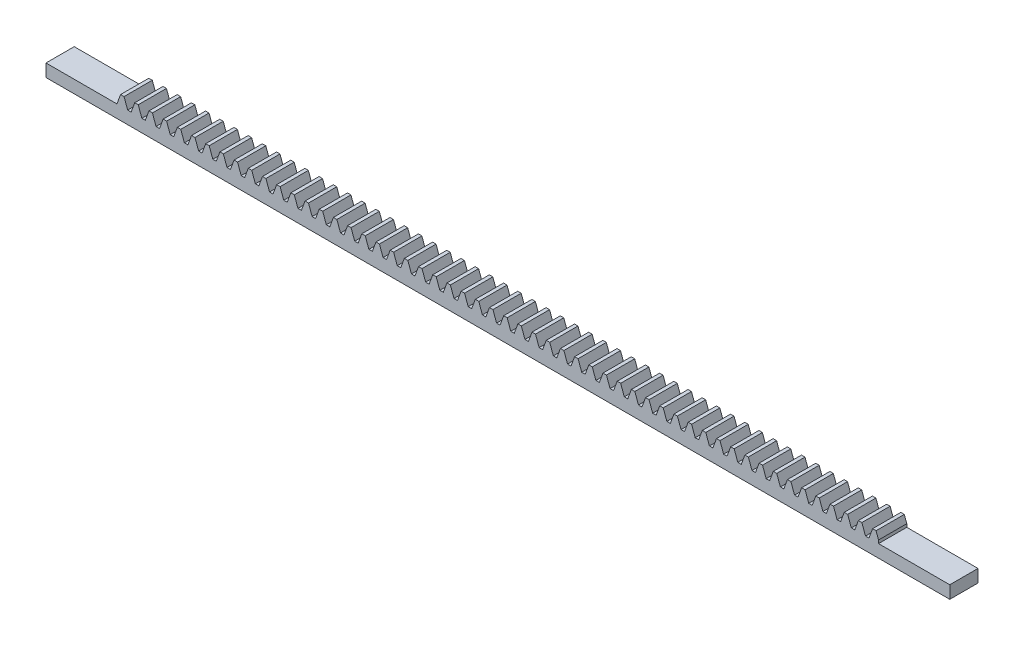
SolidWorks part; units mm, degrees
ref_plane "Plan de face" through (0, 0, 0) normal (0, 0, 1) x (1, 0, 0)
ref_plane "Plan de dessus" through (0, 0, 0) normal (0, 1, 0) x (1, 0, 0)
ref_plane "Plan de droite" through (0, 0, 0) normal (1, 0, 0) x (0, 0, -1)
sketch "Esquisse1" plane through (0, 0, 0) normal (0, 0, 1) x (1, 0, 0)
  line L1 (0, 0) -> (160, 0)
  line L2 (0, 0) -> (0, 4)
  line L3 (0, 4) -> (160, 4)
  line L4 (160, 0) -> (160, 4)
  dimension "D1" = 4
  dimension "D2" = 160
extrude "Boss.-Extru.1" add sketch "Esquisse1" along normal mid plane 5
sketch "Esquisse2" plane through (0, 0, 2.5) normal (0, 0, 1) x (1, 0, 0)
  line L0 (0.6406, 4) -> (0, 2.24)
  line L1 (0, 2.24) -> (-0.6154, 2.24)
  line L2 (-0.6154, 2.24) -> (-1.256, 4)
  line L3 (-1.256, 4) -> (0.6406, 4)
  line L4 (0, 11.789) -> (0, -2.5174) construction
  line L5 (2.512, 11.789) -> (2.512, -2.5174) construction
  line L6 (-0.8493, 7) -> (21.7954, 7) construction
  line L7 (0, 0) -> (160, 0) construction
  line L8 (160, 4) -> (0, 4) construction
  line L9 (0, 4) -> (0, 0) construction
  dimension "D1" = 2.512
  dimension "D2" = 70
  dimension "D3" = 70
  dimension "D4" = 1.256
  dimension "D5" = 7
  dimension "D6" = 1.76
extrude "Enlèv. mat.-Extru.1" cut sketch "Esquisse2" against normal blind 10
pattern_linear "Répétition linéaire1" count 63 spacing 2.512 along (0.9397, -0.342, 0) of "Enlèv. mat.-Extru.1"
sketch "Esquisse3" plane through (0, 0, 2.5) normal (0, 0, 1) x (1, 0, 0)
  line L1 (0, 2.24) -> (12.2206, 2.24)
  line L2 (0, 2.24) -> (0, 9.3127)
  line L3 (0, 9.3127) -> (12.2206, 9.3127)
  line L4 (12.2206, 2.24) -> (12.2206, 9.3127)
  line L5 (160, 2.24) -> (147.3902, 2.24)
  line L6 (160, 2.24) -> (160, 8.0225)
  line L7 (160, 8.0225) -> (147.3902, 8.0225)
  line L8 (147.3902, 2.24) -> (147.3902, 8.0225)
extrude "Enlèv. mat.-Extru.2" cut sketch "Esquisse3" against normal blind 10
